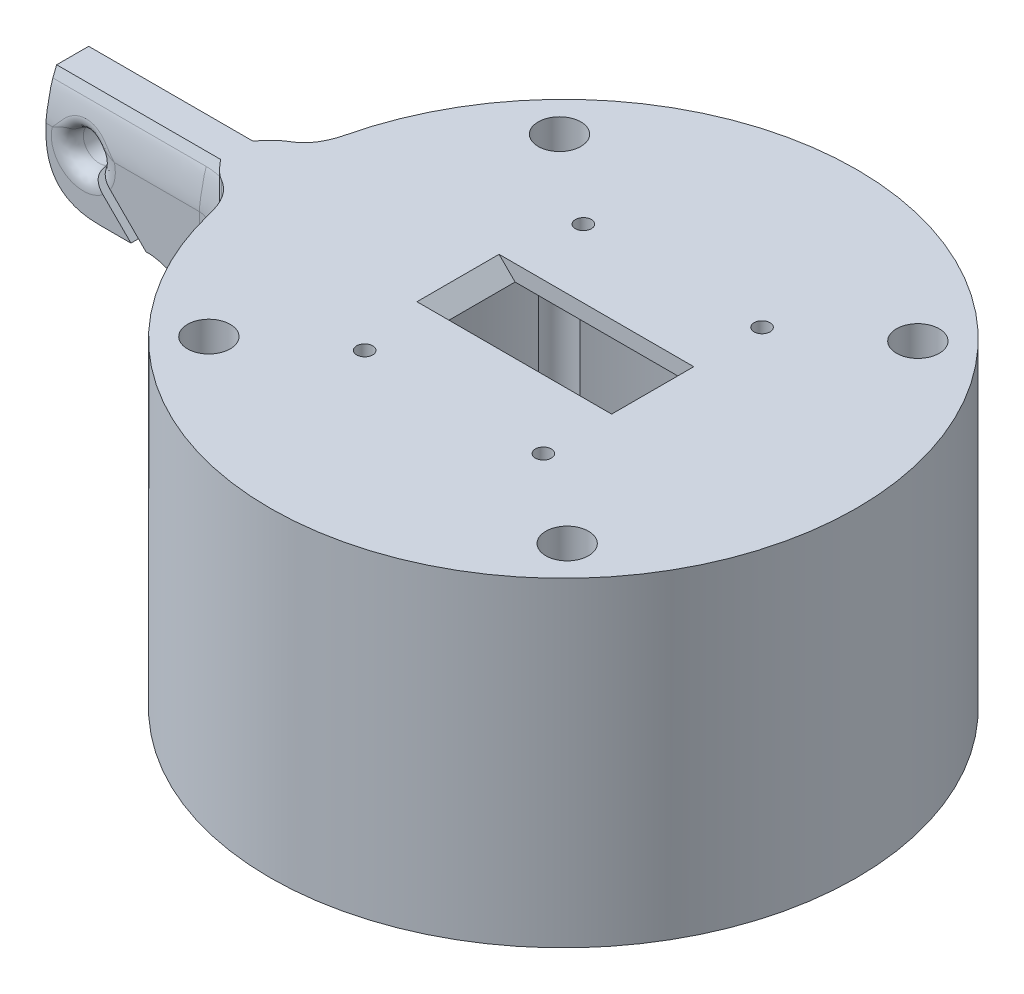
SolidWorks part; units mm, degrees
ref_plane "Спереди" through (0, 0, 0) normal (0, 0, 1) x (1, 0, 0)
ref_plane "Сверху" through (0, 0, 0) normal (0, 1, 0) x (1, 0, 0)
ref_plane "Справа" through (0, 0, 0) normal (1, 0, 0) x (0, 0, -1)
sketch "Эскиз1" plane through (0, 0, 0) normal (0, 1, 0) x (1, 0, 0)
  circle A0 centre (0, 0) radius 55
  dimension "D1" = 110
extrude "Бобышка-Вытянуть1" add sketch "Эскиз1" along normal blind 60
sketch "Эскиз2" plane through (0, 0, 0) normal (0, -1, 0) x (1, 0, 0)
  circle A0 centre (0, 0) radius 50
  dimension "D1" = 100
extrude "Вырез-Вытянуть1" cut sketch "Эскиз2" against normal blind 50
sketch "Эскиз3" plane through (0, 50, 0) normal (0, -1, 0) x (1, 0, 0)
  line L1 (-16.75, -7.7) -> (16.75, -7.7)
  line L2 (-16.75, -7.7) -> (-16.75, 7.7)
  line L3 (-16.75, 7.7) -> (16.75, 7.7)
  line L4 (16.75, -7.7) -> (16.75, 7.7)
  line L5 (-16.75, -7.7) -> (16.75, 7.7) construction
  line L6 (-16.75, 7.7) -> (16.75, -7.7) construction
  point P0 (0, 0)
  dimension "D1" = 15.4
  dimension "D2" = 33.5
extrude "Вырез-Вытянуть2" cut sketch "Эскиз3" against normal through all
sketch "Эскиз4" plane through (0, 60, 0) normal (0, 1, 0) x (1, 0, 0)
  line L0 (-16.75, 20.5) -> (-16.75, -20.5) construction
  line L1 (-16.75, -20.5) -> (16.75, -20.5) construction
  line L2 (16.75, -20.5) -> (16.75, 20.5) construction
  line L3 (16.75, 20.5) -> (-16.75, 20.5) construction
  line L4 (-23.35, 22.85) -> (23.35, 22.85) construction
  line L5 (16.75, -20.5) -> (-16.75, 20.5) construction
  line L6 (16.75, 20.5) -> (-16.75, -20.5) construction
  line L7 (23.35, 22.85) -> (23.35, -22.85) construction
  line L8 (39.3095, -38.4677) -> (-39.3095, 38.4677) construction
  line L9 (23.35, -22.85) -> (-23.35, -22.85) construction
  line L10 (-23.35, -22.85) -> (-23.35, 22.85) construction
  line L11 (16.75, 7.7) -> (16.75, -7.7) construction
  line L13 (23.35, -22.85) -> (-23.35, 22.85) construction
  line L14 (-16.75, -7.7) -> (-16.75, 7.7) construction
  line L15 (39.3095, 38.4677) -> (-39.3095, -38.4677) construction
  line L16 (23.35, 22.85) -> (-23.35, -22.85) construction
  circle A0 centre (-16.75, 20.5) radius 1.5
  circle A1 centre (16.75, 20.5) radius 1.5
  circle A2 centre (-16.75, -20.5) radius 1.5
  circle A3 centre (16.75, -20.5) radius 1.5
  circle A4 centre (0, 0) radius 55 construction
  circle A5 centre (33.5917, -32.8724) radius 4
  circle A6 centre (-33.5917, -32.8724) radius 4
  circle A7 centre (-33.5917, 32.8724) radius 4
  circle A8 centre (33.5917, 32.8724) radius 4
  point P0 (0, 0)
  point P5 (0, 0)
  point P27 (-16.75, 0)
  point P29 (16.75, 0)
  point P33 (-16.75, 0)
  dimension "D3" = 3
  dimension "D4" = 8
  dimension "D1" = 46.7
  dimension "D2" = 41
  dimension "D5" = 8
  dimension "D6" = 8
  dimension "D7" = 8
  dimension "D8" = 8
  dimension "D9" = 45.7
  dimension "D10" = 33.5
extrude "Вырез-Вытянуть3" cut sketch "Эскиз4" against normal through all
sketch "Эскиз6" plane through (0, 50, 0) normal (0, -1, 0) x (1, 0, 0)
  line L1 (-22.5, -32.5) -> (22.5, -32.5)
  line L2 (-32.5, -22.5) -> (-32.5, 22.5)
  line L3 (-22.5, 32.5) -> (22.5, 32.5)
  line L4 (32.5, -22.5) -> (32.5, 22.5)
  line L5 (-32.5, -32.5) -> (32.5, 32.5) construction
  line L6 (-32.5, 32.5) -> (32.5, -32.5) construction
  arc A0 (32.5, 22.5) -> (22.5, 32.5) centre (22.5, 22.5) ccw
  arc A1 (32.5, -22.5) -> (22.5, -32.5) centre (22.5, -22.5) cw
  arc A2 (-32.5, 22.5) -> (-22.5, 32.5) centre (-22.5, 22.5) cw
  arc A3 (-32.5, -22.5) -> (-22.5, -32.5) centre (-22.5, -22.5) ccw
  point P0 (0, 0)
  dimension "D3" = 10
  dimension "D1" = 65
  dimension "D2" = 65
extrude "Вырез-Вытянуть4" cut sketch "Эскиз6" against normal blind 7
chamfer "Фаска1" distance 3 angle 45 1 edges at (-16.75, 60, 0)
sketch "Sketch1" plane through (0, 60, 0) normal (0, 1, 0) x (1, 0, 0)
  line L0 (-52, -17.9165) -> (-52, 17.9165) construction
  line L2 (-92, 5) -> (-52, 5)
  line L3 (-92, 5) -> (-92, -5)
  line L4 (-92, -5) -> (-52, -5)
  line L5 (-52, 5) -> (-52, -5)
  line L6 (-92, 5) -> (-52, -5) construction
  line L7 (-92, -5) -> (-52, 5) construction
  circle A0 centre (0, 0) radius 55 construction
  point P4 (-72, 0)
  point P10 (-52, 0)
  point P11 (-52, 0)
  dimension "D1" = 52
  dimension "D2" = 40
  dimension "D3" = 10
extrude "Boss-Extrude1" add sketch "Sketch1" against normal blind 20
sketch "Sketch2" plane through (0, 0, -5) normal (0, 0, -1) x (-1, 0, 0)
  line L0 (92, 50) -> (54.7723, 50) construction
  line L1 (92, 40) -> (92, 60) construction
  line L2 (54.7723, 40) -> (54.7723, 60) construction
  circle A0 centre (85, 50) radius 3
  dimension "D1" = 6
  dimension "D2" = 7
extrude "Cut-Extrude1" cut sketch "Sketch2" against normal through all
fillet "Fillet1" radius 3 2 edges at (-82, 50, 5) (-88, 50, -5)
fillet "Fillet2" radius 10 1 edges at (-92, 40, 0)
fillet "Fillet5" radius 10 2 edges at (-54.7723, 50, 5) (-54.7723, 50, -5)
sketch "Sketch4" plane through (0, 0, -5) normal (0, 0, -1) x (-1, 0, 0)
  line L0 (73.2456, 40) -> (84.5593, 51.3137)
  line L2 (84.5593, 51.3137) -> (85.9735, 49.8995)
  line L3 (85.9735, 49.8995) -> (76.074, 40)
  line L4 (63.2456, 40) -> (82, 40) construction
  line L5 (76.074, 40) -> (73.2456, 40) construction
  point P2 (0, 0)
  point P3 (0, 0)
  point P4 (0, 0)
  point P9 (76.3481, 41.3667)
  point P10 (0, 0)
  point P11 (85.528, 54)
  dimension "D1" = 10
  dimension "D2" = 14
  dimension "D3" = 45
  dimension "D4" = 2
extrude "Cut-Extrude3" cut sketch "Sketch4" against normal through all
fillet "Fillet7" radius 18 1 edges
sketch "Sketch6" plane through (-92, 0, 0) normal (-1, 0, 0) x (0, 0, 1)
  line L0 (5, 55) -> (5, 60)
  line L1 (5, 50) -> (5, 60) construction
  line L2 (5, 60) -> (3, 60)
  line L3 (-5, 60) -> (5, 60) construction
  line L4 (3, 60) -> (5, 55)
  line L5 (-3, 60) -> (-5, 60)
  line L6 (-5, 60) -> (-5, 55)
  line L7 (-5, 50) -> (-5, 60) construction
  line L8 (-5, 55) -> (-3, 60)
  dimension "D1" = 5
  dimension "D2" = 2
extrude "Cut-Extrude5" cut sketch "Sketch6" against normal blind 25
fillet "Fillet9" radius 18 2 edges at (-67, 57.5, 5) (-67, 57.5, -5)
fillet "Fillet10" radius 18 4 edges at (-59.5695, 53.7188, 5.5125) (-61.334, 54.6893, -5.1243)
fillet "Fillet11" radius 2 2 edges
